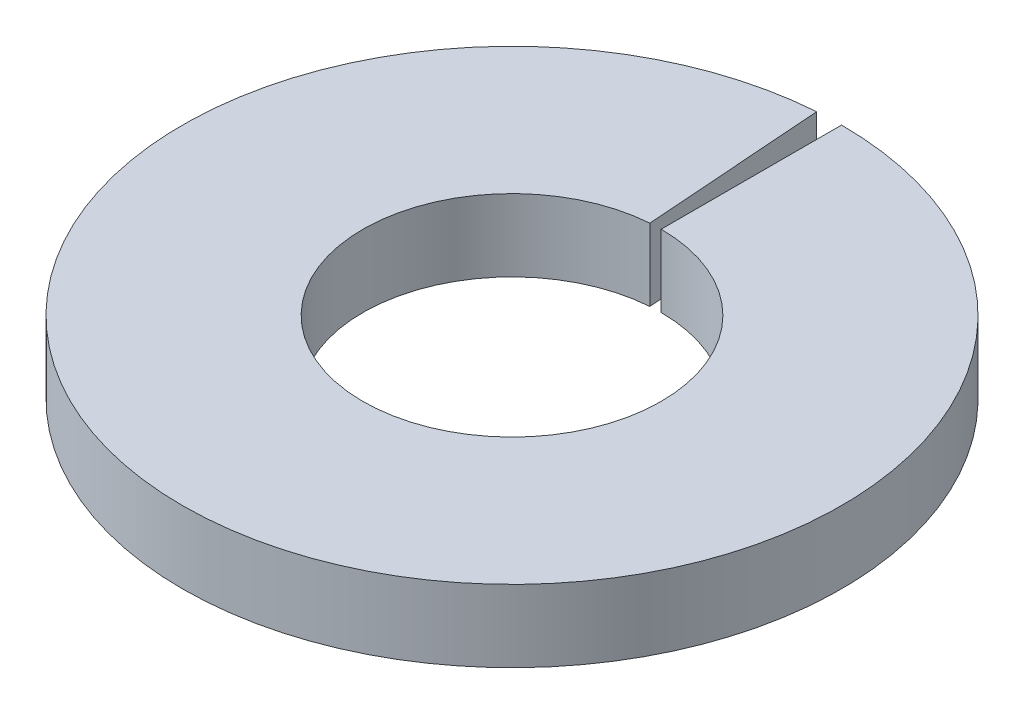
SolidWorks part; units mm, degrees
ref_plane "Front Plane" through (0, 0, 0) normal (0, 0, 1) x (1, 0, 0)
ref_plane "Top Plane" through (0, 0, 0) normal (0, 1, 0) x (1, 0, 0)
ref_plane "Right Plane" through (0, 0, 0) normal (1, 0, 0) x (0, 0, -1)
sketch "Sketch1" plane through (0, 0, 0) normal (0, 1, 0) x (1, 0, 0)
  line L0 (-0.0575, 0.7853) -> (-0.127, 1.7353)
  line L1 (0, 0.7874) -> (0, 1.7399)
  line L2 (0, 0) -> (-0.0575, 0.7853) construction
  line L3 (0, 0) -> (0, 0.7874) construction
  arc A0 (-0.127, 1.7353) -> (0, 1.7399) centre (0, 0) ccw
  arc A1 (-0.0575, 0.7853) -> (0, 0.7874) centre (0, 0) ccw
  dimension "D1" = 3.4798
  dimension "D2" = 1.5748
  dimension "D3" = 0.127
extrude "Boss-Extrude1" add sketch "Sketch1" along normal blind 0.381
